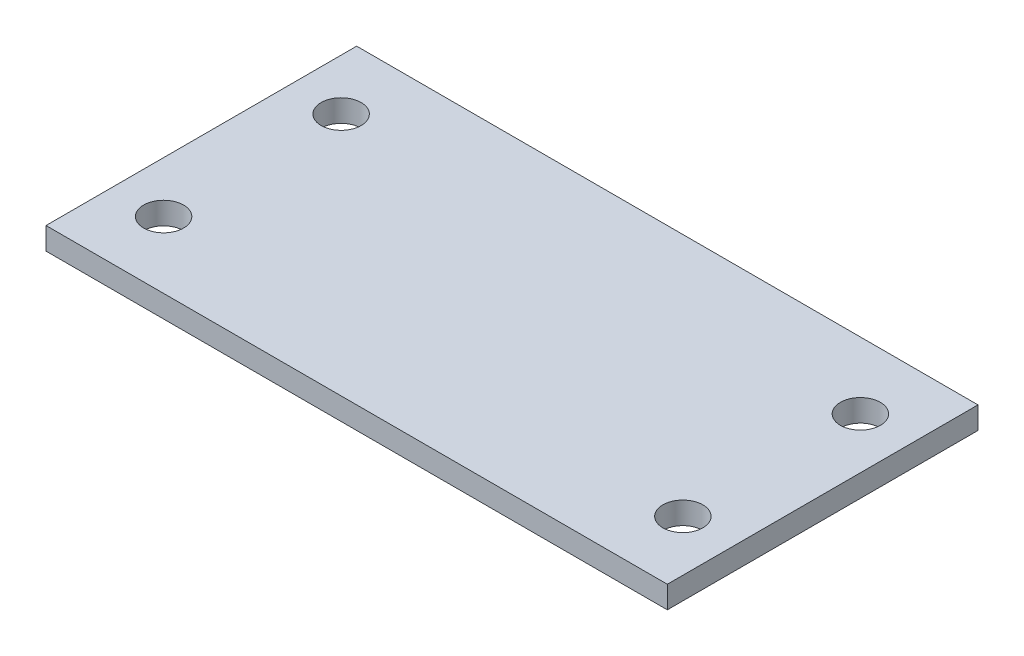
SolidWorks part; units mm, degrees
ref_plane "Front Plane" through (0, 0, 0) normal (0, 0, 1) x (1, 0, 0)
ref_plane "Top Plane" through (0, 0, 0) normal (0, 1, 0) x (1, 0, 0)
ref_plane "Right Plane" through (0, 0, 0) normal (1, 0, 0) x (0, 0, -1)
sketch "Sketch1" plane through (0, 0, 0) normal (0, 1, 0) x (1, 0, 0)
  line L1 (0, 0) -> (70, 0)
  line L2 (0, 0) -> (0, 35)
  line L3 (0, 35) -> (70, 35)
  line L4 (70, 0) -> (70, 35)
  dimension "D1" = 70
  dimension "D2" = 35
extrude "Boss-Extrude1" add sketch "Sketch1" along normal blind 2.5
sketch "Sketch2" plane through (0, 2.5, 0) normal (0, 1, 0) x (1, 0, 0)
  line L1 (70, 35) -> (0, 35) construction
  circle A0 centre (5.75, 27.5) radius 2.25
  point P2 (0, 0)
  point P6 (8.1367, 7.5)
  point P7 (0, 0)
  point P10 (35, 35)
  dimension "D2" = 4.5
  dimension "D1" = 29.25
  dimension "D3" = 7.5
extrude "Cut-Extrude1" cut sketch "Sketch2" against normal through all
pattern_linear "LPattern1" count 2 spacing 58.5 along (1, 0, 0) count 2 spacing 20 along (0, 0, 1) of "Cut-Extrude1"
